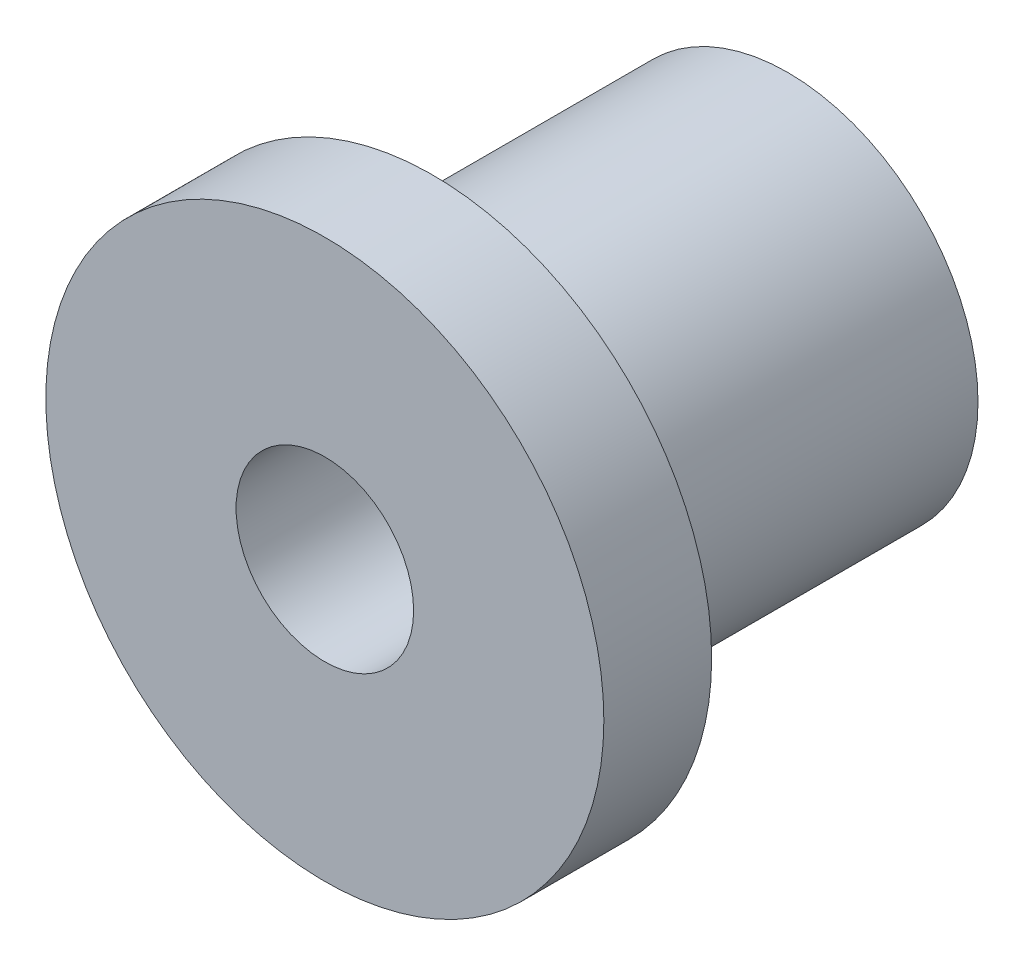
SolidWorks part; units mm, degrees
ref_plane "Plane1" through (0, 0, 0) normal (0, 0, 1) x (1, 0, 0)
ref_plane "Plane2" through (0, 0, 0) normal (0, 1, 0) x (1, 0, 0)
ref_plane "Plane3" through (0, 0, 0) normal (1, 0, 0) x (0, 0, -1)
sketch "Sketch1" plane through (0, 0, 0) normal (0, 0, 1) x (1, 0, 0)
  circle A0 centre (0, 0) radius 3.81
  dimension "D1" = 7.62
extrude "Base-Extrude" add sketch "Sketch1" along normal blind 7.112
sketch "Sketch5" plane through (0, 0, 7.112) normal (0, 0, 1) x (1, 0, 0)
  circle A0 centre (0, 0) radius 5.588
  dimension "D1" = 11.176
extrude "Boss-Extrude4" add sketch "Sketch5" along normal blind 2.159
sketch "Sketch6" plane through (0, 0, 9.271) normal (0, 0, 1) x (1, 0, 0)
  circle A0 centre (0, 0) radius 1.778
  dimension "D1" = 3.556
extrude "Cut-Extrude1" cut sketch "Sketch6" against normal blind 2.794
